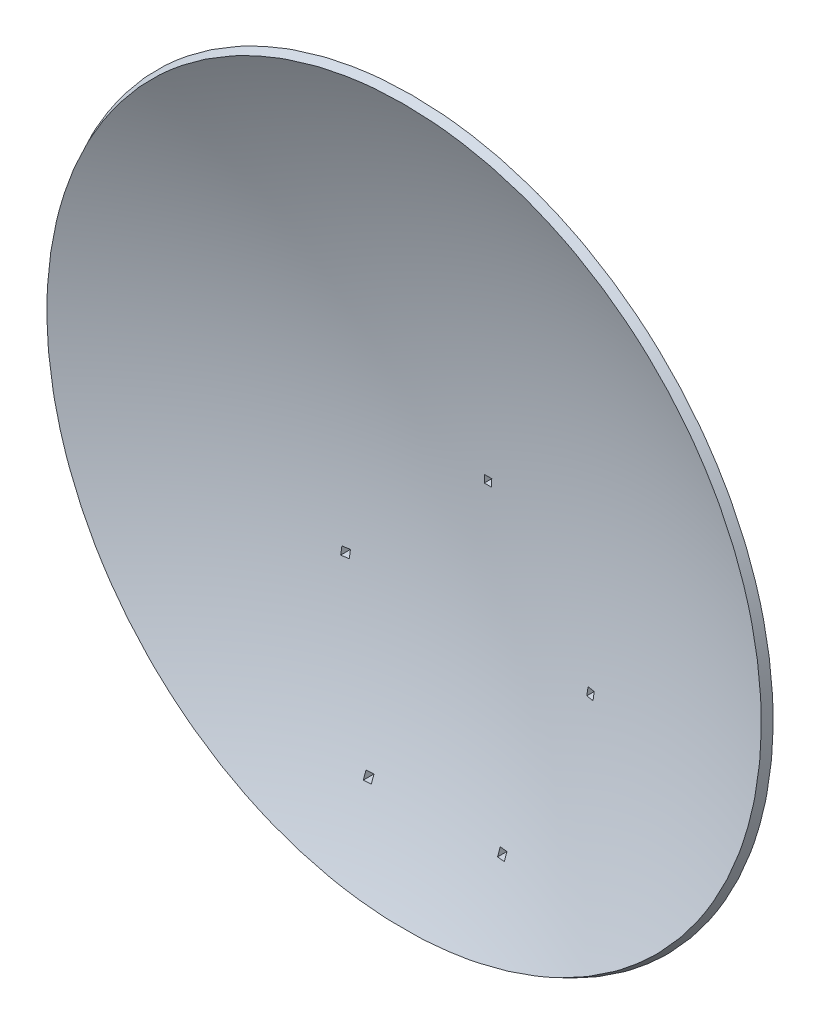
SolidWorks part; units mm, degrees
ref_plane "Front Plane" through (0, 0, 0) normal (0, 0, 1) x (1, 0, 0)
ref_plane "Top Plane" through (0, 0, 0) normal (0, 1, 0) x (1, 0, 0)
ref_plane "Right Plane" through (0, 0, 0) normal (1, 0, 0) x (0, 0, -1)
sketch "Sketch2" plane through (0, 0, 0) normal (1, 0, 0) x (0, 0, -1)
  line L0 (0, 0) -> (-430.8715, 0) construction
  line L1 (0, 0) -> (-10, 0)
  line L2 (-95.2907, 405.2556) -> (-104.3399, 401)
  parabola Q0
  spline S0 degree 1 poles (-10, 0) (-104.3399, 401) knots 0 0 1 1 construction
  spline S1 degree 3 poles (-10, 0) (-10, 16.6972) (-10.9811, 50.0656) (-15.3964, 100.1452) (-22.757, 150.2311) (-33.0654, 200.3354) (-46.3247, 250.4607) (-59.8361, 292.2524) (-72.1248, 325.7) (-82.0807, 350.7911) (-90.9969, 371.7117) (-98.4947, 388.4398) (-102.3775, 396.827) (-104.3399, 401) knots 0.5 0.5 0.5 0.5 0.50061 0.50122 0.50183 0.50244 0.503051 0.503661 0.503966 0.504271 0.504576 0.504728 0.504881 0.504881 0.504881 0.504881
  point P9 (-144.6094, 0)
  point P10 (-430.8715, 0)
  dimension "D2" = 802
  dimension "D1" = 10
revolve "Revolve6" add sketch "Sketch2" angle 360 about L0
sketch "Sketch3" plane through (0, 0, 0) normal (0, 0, 1) x (1, 0, 0)
  line L0 (1054.035, 1273.8206) -> (1054.035, -70.1794) construction
  line L1 (-4.145, -8.1805) -> (4.145, -8.1805)
  line L2 (-4.145, -8.1805) -> (-4.145, -16.4705)
  line L3 (-4.145, -16.4705) -> (4.145, -16.4705)
  line L4 (4.145, -8.1805) -> (4.145, -16.4705)
  line L5 (-4.145, -12.3255) -> (4.145, -12.3255) construction
  line L6 (0, -12.3255) -> (-137.5, -139.3255) construction
  line L7 (-137.5, -139.3255) -> (-75, -308.3255) construction
  line L8 (-75, -308.3255) -> (75, -308.3255) construction
  line L9 (75, -308.3255) -> (137.5, -139.3255) construction
  line L10 (137.5, -139.3255) -> (0, -12.3255) construction
  line L11 (0, -8.1805) -> (0, -16.4705) construction
  line L12 (-137.5, -139.3255) -> (137.5, -139.3255) construction
  line L14 (-141.645, -143.4705) -> (-133.355, -143.4705)
  line L15 (-141.645, -143.4705) -> (-141.645, -135.1805)
  line L16 (-141.645, -135.1805) -> (-133.355, -135.1805)
  line L17 (-133.355, -143.4705) -> (-133.355, -135.1805)
  line L18 (-141.645, -143.4705) -> (-133.355, -135.1805) construction
  line L19 (-141.645, -135.1805) -> (-133.355, -143.4705) construction
  line L20 (133.355, -143.4705) -> (141.645, -143.4705)
  line L21 (133.355, -143.4705) -> (133.355, -135.1805)
  line L22 (133.355, -135.1805) -> (141.645, -135.1805)
  line L23 (141.645, -143.4705) -> (141.645, -135.1805)
  line L24 (133.355, -143.4705) -> (141.645, -135.1805) construction
  line L25 (133.355, -135.1805) -> (141.645, -143.4705) construction
  line L26 (70.855, -312.4705) -> (79.145, -312.4705)
  line L27 (70.855, -312.4705) -> (70.855, -304.1805)
  line L28 (70.855, -304.1805) -> (79.145, -304.1805)
  line L29 (79.145, -312.4705) -> (79.145, -304.1805)
  line L30 (70.855, -312.4705) -> (79.145, -304.1805) construction
  line L31 (70.855, -304.1805) -> (79.145, -312.4705) construction
  line L32 (-79.145, -312.4705) -> (-70.855, -312.4705)
  line L33 (-79.145, -312.4705) -> (-79.145, -304.1805)
  line L34 (-79.145, -304.1805) -> (-70.855, -304.1805)
  line L35 (-70.855, -312.4705) -> (-70.855, -304.1805)
  line L36 (-79.145, -312.4705) -> (-70.855, -304.1805) construction
  line L37 (-79.145, -304.1805) -> (-70.855, -312.4705) construction
  point P8 (0, -12.3255)
  point P9 (0, -139.3255)
  point P10 (0, -308.3255)
  point P34 (0, 0)
  dimension "D1" = 8.29
  dimension "D2" = 275
  dimension "D3" = 296
  dimension "D4" = 150
  dimension "D5" = 127
  dimension "D6" = 8.29
  dimension "D7" = 8.29
  dimension "D8" = 8.29
  dimension "D9" = 8.29
sketch "Sketch4" plane through (0, 0, 0) normal (0, 0, 1) x (1, 0, 0)
  line L0 (0, 0) -> (0, -176.8162)
  line L1 (-584.5238, 562.3689) -> (759.4762, 562.3689) construction
  circle A0 centre (-475.4892, 79.6183) radius 401.4481
sketch "Sketch5" plane through (0, 0, 0) normal (0, 0, 1) x (1, 0, 0)
  line L0 (947.6656, -296.4553) -> (954.1277, -296.4553)
  line L1 (954.1277, -296.4553) -> (954.1277, -302.7654)
  line L2 (954.1277, -302.7654) -> (954.1277, -341.401)
  line L3 (954.1277, -341.401) -> (1034.2392, -341.401)
  line L4 (75, -359.0855) -> (75, -308.3255)
  line L5 (75, -359.0855) -> (180.25, -359.0855)
  point P7 (78.2194, -300.5366)
  point P8 (0, 0)
  point P10 (75, -199.6664)
  point P11 (180.25, -250.4264)
  point P12 (0, 0)
  dimension "D1" = 50.76
  dimension "D2" = 105.25
extrude "Cut-Extrude2" cut sketch "Sketch3" against normal through all both and the other way through all contours L4 L1 L2 L3 | L23 L22 L21 L20 | L15 L16 L17 L14 | L35 L34 L33 L32 | L27 L28 L29 L26
